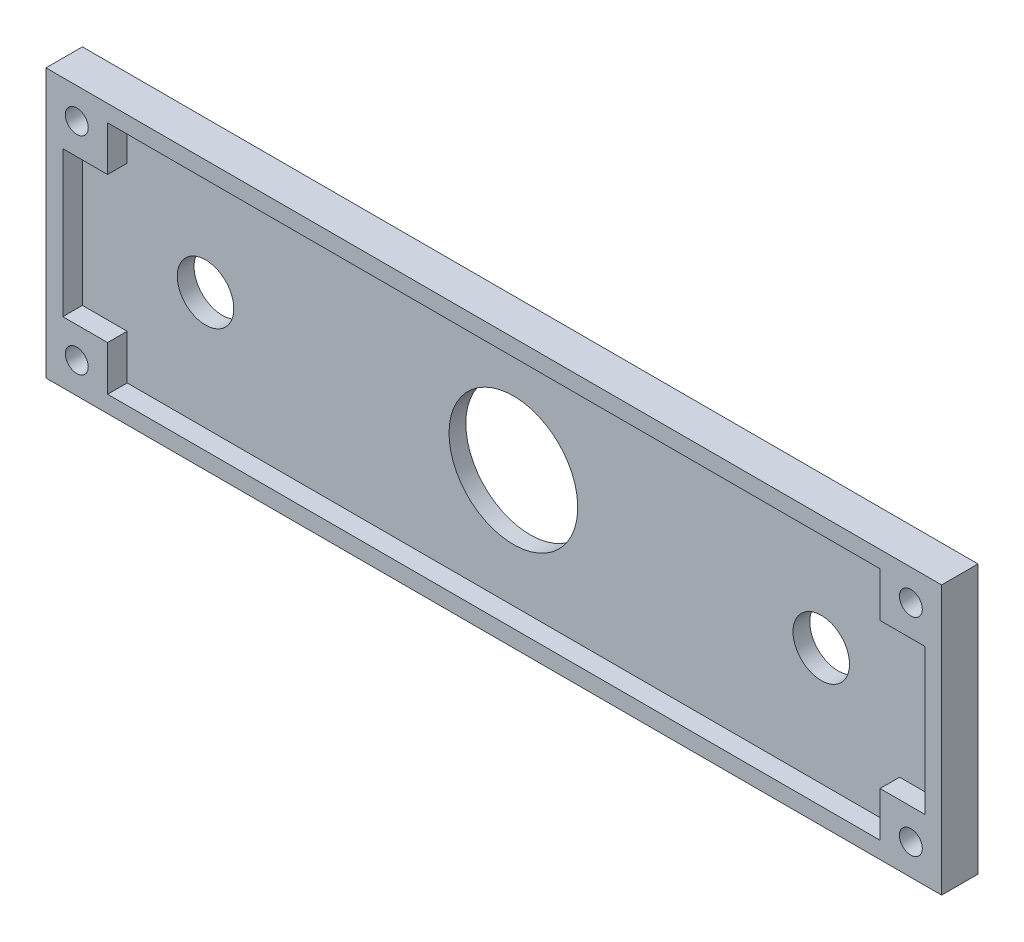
SolidWorks part; units mm, degrees
ref_plane "Ebene vorne" through (0, 0, 0) normal (0, 0, 1) x (1, 0, 0)
ref_plane "Ebene oben" through (0, 0, 0) normal (0, 1, 0) x (1, 0, 0)
ref_plane "Ebene rechts" through (0, 0, 0) normal (1, 0, 0) x (0, 0, -1)
sketch "Skizze1" plane through (0, 0, 0) normal (0, 0, 1) x (1, 0, 0)
  line L13 (-81.0563, 24) -> (78.9437, 24)
  line L14 (-81.0563, 24) -> (-81.0563, -24)
  line L15 (-81.0563, -24) -> (78.9437, -24)
  line L16 (78.9437, 24) -> (78.9437, -24)
  point P0 (-79.0563, 22)
  point P1 (76.9437, -22)
  point P2 (-79.0563, -22)
  point P3 (76.9437, 22)
  dimension "D1" = 160
  dimension "D2" = 48
extrude "Aufsatz-Linear austragen1" add sketch "Skizze1" along normal blind 6.5
sketch "Skizze2" plane through (0, 0, 6.5) normal (0, 0, 1) x (1, 0, 0)
  line L0 (-70.0563, 21) -> (67.9437, 21)
  line L1 (-78.0563, 13) -> (-78.0563, -13)
  line L2 (-70.0563, -21) -> (67.9437, -21)
  line L3 (75.9437, 13) -> (75.9437, -13)
  line L4 (-78.0563, -13) -> (-70.0563, -13)
  line L5 (-70.0563, -13) -> (-70.0563, -21)
  line L6 (-70.0563, 21) -> (-70.0563, 13)
  line L7 (-70.0563, 13) -> (-78.0563, 13)
  line L8 (67.9437, -21) -> (67.9437, -13)
  line L9 (67.9437, -13) -> (75.9437, -13)
  line L10 (67.9437, 21) -> (67.9437, 13)
  line L11 (67.9437, 13) -> (75.9437, 13)
  line L12 (78.9437, -24) -> (78.9437, 24) construction
  line L13 (-81.0563, -24) -> (78.9437, -24) construction
  line L14 (78.9437, 24) -> (-81.0563, 24) construction
  line L15 (-81.0563, 24) -> (-81.0563, -24) construction
  point P20 (0, 0)
  dimension "D1" = 3
  dimension "D2" = 3
  dimension "D3" = 3
  dimension "D4" = 3
  dimension "D5" = 11
  dimension "D6" = 11
  dimension "D7" = 11
  dimension "D8" = 11
  dimension "D9" = 11
  dimension "D10" = 11
  dimension "D11" = 11
  dimension "D12" = 11
extrude "Schnitt-Linear austragen1" cut sketch "Skizze2" against normal blind 3.5
sketch "Skizze3" plane through (0, 0, 0) normal (0, 0, -1) x (-1, 0, 0)
  line L0 (1.0563, 24) -> (1.0563, -24) construction
  line L1 (-78.9437, 24) -> (81.0563, 24) construction
  line L2 (81.0563, -24) -> (-78.9437, -24) construction
  line L3 (-78.9437, 0) -> (81.0563, 0) construction
  line L4 (-78.9437, -24) -> (-78.9437, 24) construction
  line L5 (81.0563, 24) -> (81.0563, -24) construction
  circle A0 centre (-73.4437, 18.5) radius 2.05
  circle A1 centre (75.5563, 18.5) radius 2.05
  circle A2 centre (75.5563, -18.5) radius 2.05
  circle A3 centre (-73.4437, -18.5) radius 2.05
  dimension "D1" = 4.1
  dimension "D2" = 5.5
  dimension "D3" = 5.5
extrude "Schnitt-Linear austragen2" cut sketch "Skizze3" against normal blind 10
sketch "Skizze4" plane through (0, 0, 0) normal (0, 0, -1) x (-1, 0, 0)
  line L0 (1.0563, 24) -> (1.0563, -24) construction
  line L1 (-78.9437, 24) -> (81.0563, 24) construction
  line L2 (81.0563, -24) -> (-78.9437, -24) construction
  line L3 (-78.9437, 0) -> (81.0563, 0) construction
  line L4 (-78.9437, -24) -> (-78.9437, 24) construction
  line L5 (81.0563, 24) -> (81.0563, -24) construction
  circle A0 centre (-73.4437, 18.5) radius 4
  circle A1 centre (75.5563, 18.5) radius 4
  circle A2 centre (75.5563, -18.5) radius 4
  circle A3 centre (-73.4437, -18.5) radius 4
  dimension "D1" = 8
extrude "Schnitt-Linear austragen3" cut sketch "Skizze4" against normal blind 3.5
sketch "Skizze5" plane through (0, 0, 0) normal (0, 0, -1) x (-1, 0, 0)
  line L0 (1.0563, 24) -> (1.0563, -24) construction
  line L1 (-78.9437, 24) -> (81.0563, 24) construction
  line L2 (81.0563, -24) -> (-78.9437, -24) construction
  line L3 (-78.9437, 0) -> (81.0563, 0) construction
  line L4 (-78.9437, -24) -> (-78.9437, 24) construction
  line L5 (81.0563, 24) -> (81.0563, -24) construction
  circle A0 centre (1.0563, 0) radius 11.5
  circle A1 centre (-53.9437, 0) radius 5.05
  circle A2 centre (56.0563, 0) radius 5.05
  circle A4 centre (-73.4437, 18.5) radius 2.05 construction
  circle A5 centre (-73.4437, 18.5) radius 2.05 construction
  dimension "D1" = 23
  dimension "D3" = 10.1
  dimension "D2" = 25
extrude "Schnitt-Linear austragen4" cut sketch "Skizze5" against normal blind 3.5
